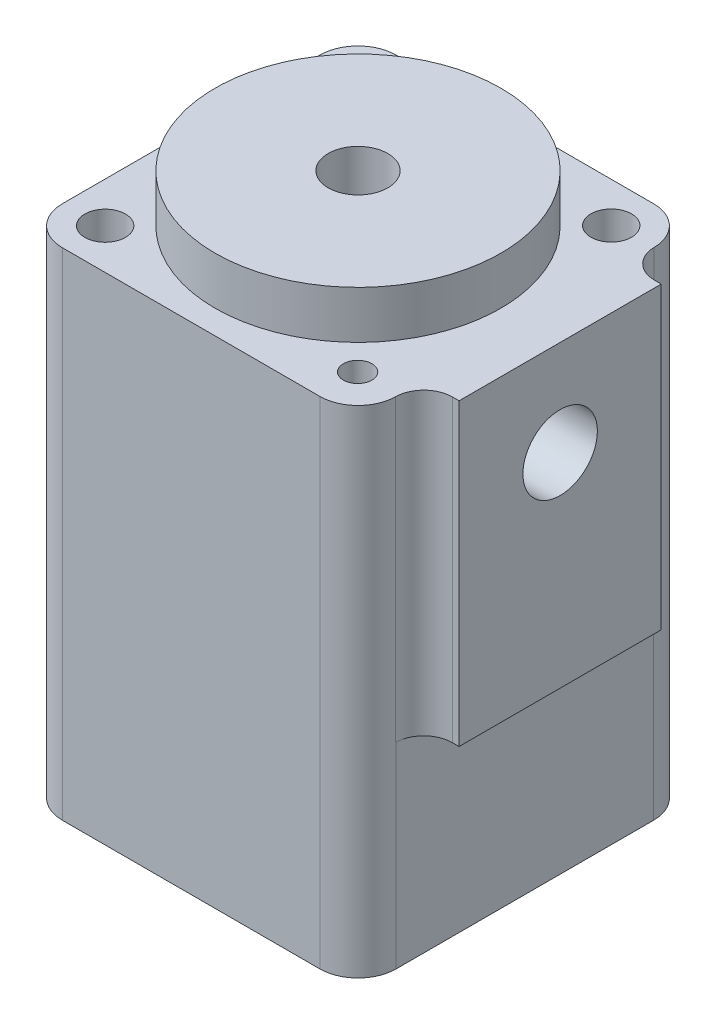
SolidWorks part; units mm, degrees
ref_plane "Front Plane" through (0, 0, 0) normal (0, 0, 1) x (1, 0, 0)
ref_plane "Top Plane" through (0, 0, 0) normal (0, 1, 0) x (1, 0, 0)
ref_plane "Right Plane" through (0, 0, 0) normal (1, 0, 0) x (0, 0, -1)
sketch "Sketch2" plane through (0, 0, 0) normal (0, 1, 0) x (1, 0, 0)
  line L1 (-22.225, -22.225) -> (22.225, -22.225)
  line L2 (-22.225, -22.225) -> (-22.225, 22.225)
  line L3 (-22.225, 22.225) -> (22.225, 22.225)
  line L4 (22.225, -22.225) -> (22.225, 22.225)
  line L5 (-22.225, -22.225) -> (22.225, 22.225) construction
  line L6 (-22.225, 22.225) -> (22.225, -22.225) construction
  point P0 (0, 0)
  dimension "D1" = 44.45
  dimension "D2" = 44.45
extrude "Boss-Extrude1" add sketch "Sketch2" along normal blind 66.04
sketch "Sketch3" plane through (0, 66.04, 0) normal (0, 1, 0) x (1, 0, 0)
  circle A0 centre (0, 0) radius 19.0373
  dimension "D1" = 38.0746
extrude "Boss-Extrude2" add sketch "Sketch3" along normal blind 6.35
sketch "Sketch4" plane through (0, 72.39, 0) normal (0, 1, 0) x (1, 0, 0)
  circle A0 centre (0, 0) radius 3.9688
  dimension "D1" = 7.9375
extrude "Cut-Extrude1" cut sketch "Sketch4" against normal blind 38.1
hole_wizard "7/16-20 Tapped Hole1" positions "Sketch6" profile "Sketch5" tap size "7/16-20" standard "Ansi Inch"
sketch "Sketch6" plane through (0, 0, 0) normal (0, -1, 0) x (1, 0, 0)
  line L0 (0, 22.225) -> (0, -22.225) construction
  line L1 (-22.225, 22.225) -> (22.225, 22.225) construction
  line L2 (22.225, -22.225) -> (-22.225, -22.225) construction
  line L3 (0, 0) -> (-13.2065, 0) construction
  point P0 (0, 9.525)
  point P1 (0, -9.525)
  dimension "D1" = 19.05
  dimension "D2" = 9.525
sketch "Sketch5" plane through (0, 0, 9.525) normal (1, 0, 0) x (0, 0, -1)
  line L0 (0, 0) -> (0, 26.162)
  line L1 (0, 26.162) -> (4.9606, 26.162)
  line L2 (4.9606, 26.162) -> (4.9606, 0)
  line L5 (4.9606, 0) -> (0, 0)
  line L10 (0, 26.162) -> (-4.9606, 26.162) construction
  line L11 (0, -6.35) -> (0, 107.95) construction
  dimension "Tap Drill Dia." = 9.9212
  dimension "Tap Drill Depth" = 26.162
  dimension "Drill Angle" = 180
fillet "Fillet1" radius 5.08 4 edges at (-22.225, 33.02, -22.225) (-22.225, 33.02, 22.225) (22.225, 33.02, -22.225) (22.225, 33.02, 22.225)
sketch "Sketch7" plane through (0, 66.04, 0) normal (0, 1, 0) x (1, 0, 0)
  line L0 (22.225, 0) -> (26.924, 0) construction
  line L1 (22.225, -17.145) -> (22.225, 17.145) construction
  line L2 (22.225, 13.462) -> (26.924, 13.462)
  line L3 (26.924, 13.462) -> (26.924, -13.462)
  line L4 (26.924, -13.462) -> (22.225, -13.462)
  line L5 (0, 0) -> (0, 17.5841) construction
  line L6 (22.225, 13.462) -> (22.225, -13.462)
  dimension "D1" = 26.924
  dimension "D2" = 26.924
extrude "Boss-Extrude3" add sketch "Sketch7" against normal blind 39.878
fillet "Fillet3" radius 3.81 2 edges at (22.225, 46.101, 13.462) (22.225, 46.101, -13.462)
hole_wizard "7/16-20 Tapped Hole2" positions "Sketch9" profile "Sketch8" tap size "7/16-20" standard "Ansi Inch"
sketch "Sketch9" plane through (26.924, 0, 0) normal (1, 0, 0) x (0, 0, -1)
  line L0 (0, 66.04) -> (0, 26.162) construction
  line L1 (-13.462, 66.04) -> (13.462, 66.04) construction
  line L2 (17.145, 26.162) -> (-17.145, 26.162) construction
  point P0 (0, 53.34)
  dimension "D1" = 12.7
sketch "Sketch8" plane through (26.924, 53.34, 0) normal (0, 1, 0) x (0, 0, -1)
  line L0 (0, 0) -> (0, 26.162)
  line L1 (0, 26.162) -> (4.9606, 26.162)
  line L2 (4.9606, 26.162) -> (4.9606, 0)
  line L5 (4.9606, 0) -> (0, 0)
  line L10 (0, 26.162) -> (-4.9606, 26.162) construction
  line L11 (0, -6.35) -> (0, 107.95) construction
  dimension "Tap Drill Dia." = 9.9212
  dimension "Tap Drill Depth" = 26.162
  dimension "Drill Angle" = 180
hole_wizard "#10-24 Tapped Hole1" positions "Sketch11" profile "Sketch10" tap size "#10-24" standard "ANSI Inch"
sketch "Sketch11" plane through (0, 66.04, 0) normal (0, 1, 0) x (-1, 0, 0)
  line L0 (-20.7114, 20.7627) -> (20.7371, -20.7371) construction
  line L1 (0, 0) -> (0, 23.47) construction
  arc A0 (-17.145, 22.225) -> (-22.2245, 17.2176) centre (-17.145, 17.145) ccw construction
  arc A1 (17.145, -22.225) -> (22.225, -17.145) centre (17.145, -17.145) ccw construction
  point P0 (16.8402, -16.8354)
  point P1 (-16.8402, 16.8867)
  dimension "D1" = 16.8402
  dimension "D2" = 16.8402
sketch "Sketch10" plane through (-16.8402, 66.04, -16.8354) normal (1, 0, 0) x (0, 0, 1)
  line L0 (0, 0) -> (0, 66.04)
  line L1 (0, 66.04) -> (1.8986, 66.04)
  line L2 (1.8986, 66.04) -> (1.8986, 0)
  line L5 (1.8986, 0) -> (0, 0)
  line L11 (0, -6.35) -> (0, 107.95) construction
  dimension "Thru Tap Drill Dia." = 3.7973
  dimension "Thru Tap Drill Depth" = 66.04
hole_wizard "#3 (0.213) Diameter Hole1" positions "Sketch13" profile "Sketch14" hole size "#3" standard "Ansi Inch"
sketch "Sketch13" plane through (0, 66.04, 0) normal (0, 1, 0) x (-1, 0, 0)
  line L0 (-20.7114, -20.7627) -> (20.7371, 20.7371) construction
  line L1 (0, 0) -> (0, 17.4002) construction
  arc A0 (-22.2245, -17.2176) -> (-17.145, -22.225) centre (-17.145, -17.145) ccw construction
  arc A1 (22.225, 17.145) -> (17.145, 22.225) centre (17.145, 17.145) ccw construction
  point P0 (-16.8402, -16.8867)
  point P1 (16.8402, 16.8354)
  dimension "D1" = 16.8402
  dimension "D2" = 16.8402
sketch "Sketch14" plane through (16.8402, 66.04, -16.8867) normal (1, 0, 0) x (0, 0, 1)
  line L0 (0, 0) -> (0, 66.04)
  line L1 (0, 66.04) -> (2.7051, 66.04)
  line L2 (2.7051, 66.04) -> (2.7051, 0)
  line L5 (2.7051, 0) -> (0, 0)
  line L11 (0, -6.35) -> (0, 107.95) construction
  dimension "Thru Hole Dia." = 5.4102
  dimension "Thru Hole Depth" = 66.04
sketch "Sketch15" [suppressed] plane through (0, 0, 0) normal (0, -1, 0) x (1, 0, 0)
  arc A0 (4.0506, 0) -> (-4.0506, 0) centre (0, 9.525) ccw
  arc A1 (-4.0506, 0) -> (4.0506, 0) centre (0, -9.525) ccw
  circle A2 centre (0, 9.525) radius 4.9606 construction
  circle A3 centre (0, -9.525) radius 4.9606 construction
  dimension "D1" = 20.701
  dimension "D2" = 20.701
extrude "Cut-Extrude2" [suppressed] cut sketch "Sketch15" against normal blind 0.254
sketch "Sketch21" plane through (41.275, 0, -41.275) normal (0, 1, 0) x (1, 0, 0)
  line L0 (-41.275, -47.625) -> (-41.275, -53.975) construction
  line L1 (-38.1, -50.8) -> (-44.45, -50.8) construction
  line L4 (-41.275, -63.5) -> (-41.275, -19.05) construction
  line L5 (-58.42, -63.5) -> (-24.13, -63.5) construction
  line L6 (-24.13, -19.05) -> (-58.42, -19.05) construction
  line L7 (-41.275, -41.275) -> (-69.2947, -41.275) construction
  circle A0 centre (-41.275, -50.8) radius 3.175
  point P4 (-41.275, -50.8)
  dimension "D1" = 9.525
  dimension "D3" = 6.35
ref_plane "Plane1" through (0, 0, 9.525) normal (0, 0, 1) x (1, 0, 0)
sketch "Port Sketch" plane through (-41.1418, 0, 9.525) normal (0, 0, -1) x (-1, 0, 0)
  line L0 (-41.1418, 0) -> (-41.1418, 45.0293) construction
  line L1 (-41.1418, 17.2346) -> (-36.1811, 14.254)
  line L2 (-36.1811, 14.254) -> (-36.1811, 11.754)
  line L3 (-36.1811, 11.754) -> (-35.5855, 11.754)
  line L4 (-35.5855, 11.754) -> (-35.5855, 2.7644)
  line L5 (-35.5855, 2.7644) -> (-35.6751, 2.854)
  line L6 (-35.6751, 2.854) -> (-35.1652, 0.4552)
  line L7 (-34.9168, 0.254) -> (-30.6418, 0.254)
  line L8 (-30.6418, 0.254) -> (-30.6418, 0)
  line L10 (-30.6418, 0) -> (-41.1418, 0)
  line L11 (-41.1418, 0) -> (-41.1418, 17.2346)
  line L12 (-46.6084, 2.854) -> (-47.1183, 0.4552) construction
  line L13 (-46.698, 2.7644) -> (-46.6084, 2.854) construction
  line L14 (-41.1418, 17.2346) -> (-46.1024, 14.254) construction
  arc A0 (-35.1652, 0.4552) -> (-34.9168, 0.254) centre (-34.9168, 0.508) ccw
  dimension "D1" = 0.254
  dimension "Countersink angle" = 118
  dimension "D3" = 45
  dimension "TapDrillDia" = 9.9212
  dimension "D5" = 12.45
  dimension "ThdMjr" = 11.1125
  dimension "SpotDia" = 21
  dimension "L3" = 0.254
  dimension "L1" = 2.6
  dimension "ThdDp" = 11.5
  dimension "TapDrillDp" = 14
  dimension "K" = 12
revolve "SAE Port" cut sketch "Port Sketch" angle 360 about L0
other "sae j1926-1 (rectangular face)<1>"
pattern_linear "LPattern1" count 2 spacing 19.05 along (0, 0, -1) of "SAE Port"
